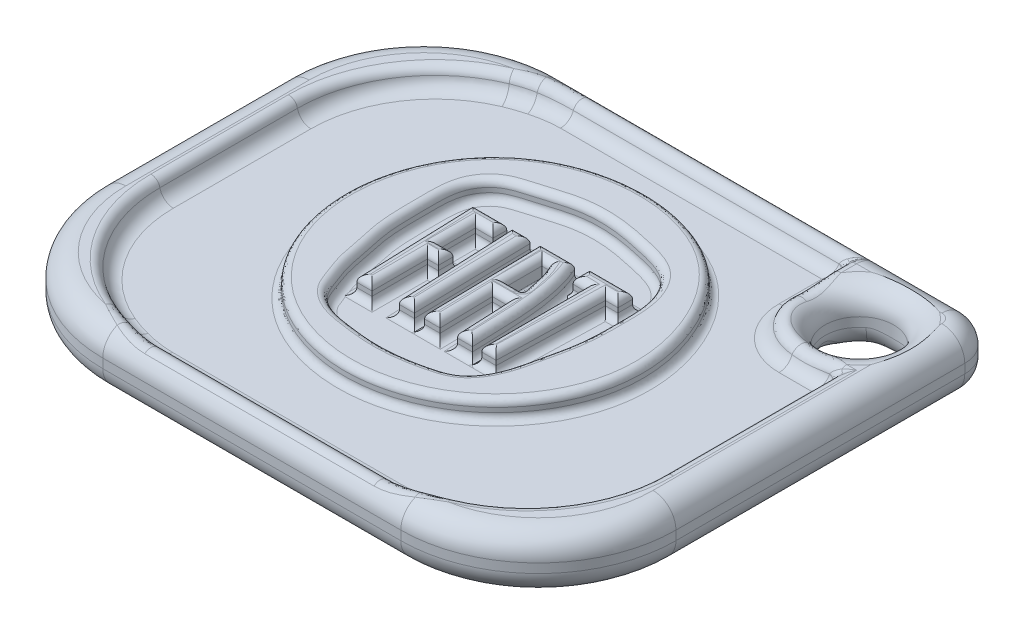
SolidWorks part; units mm, degrees
ref_plane "Ön Düzlem" through (0, 0, 0) normal (0, 0, 1) x (1, 0, 0)
ref_plane "Üst Düzlem" through (0, 0, 0) normal (0, 1, 0) x (1, 0, 0)
ref_plane "Sağ Düzlem" through (0, 0, 0) normal (1, 0, 0) x (0, 0, -1)
sketch "Çizim1" plane through (0, 0, 0) normal (0, 1, 0) x (1, 0, 0)
  line L1 (-41.6667, 37.8333) -> (53.3333, 37.8333)
  line L2 (-71.6667, 7.8333) -> (-71.6667, -32.1667)
  line L3 (-41.6667, -62.1667) -> (23.3333, -62.1667)
  line L4 (53.3333, 37.8333) -> (53.3333, -32.1667)
  arc A0 (23.3333, -62.1667) -> (53.3333, -32.1667) centre (23.3333, -32.1667) ccw
  arc A1 (-71.6667, -32.1667) -> (-41.6667, -62.1667) centre (-41.6667, -32.1667) ccw
  arc A2 (-41.6667, 37.8333) -> (-71.6667, 7.8333) centre (-41.6667, 7.8333) ccw
  circle A3 centre (38.3333, 22.8333) radius 7.5
  point P8 (-71.6667, -62.1667)
  point P11 (-71.6667, 37.8333)
  dimension "D3" = 30
  dimension "D4" = 15
  dimension "D1" = 100
  dimension "D2" = 125
  dimension "D5" = 15
extrude "Yükseklik-Ekstrüzyon1" add sketch "Çizim1" along normal blind 12
sketch "Çizim2" plane through (0, 12, 0) normal (0, 1, 0) x (1, 0, 0)
  line L0 (53.3333, 37.8333) -> (-41.6667, 37.8333) construction
  line L1 (-34.1667, 32.8333) -> (25.8333, 32.8333)
  line L2 (-64.1667, 2.8333) -> (-64.1667, -27.1667)
  line L3 (-34.1667, -57.1667) -> (15.8333, -57.1667)
  line L4 (45.8333, 10.8333) -> (45.8333, -27.1667)
  line L5 (-71.6667, 7.8333) -> (-71.6667, -32.1667) construction
  line L8 (25.8333, 32.8333) -> (25.8333, 20.8333)
  line L9 (35.8333, 10.8333) -> (45.8333, 10.8333)
  arc A0 (15.8333, -57.1667) -> (45.8333, -27.1667) centre (15.8333, -27.1667) ccw
  arc A1 (-64.1667, -27.1667) -> (-34.1667, -57.1667) centre (-34.1667, -27.1667) ccw
  arc A2 (-34.1667, 32.8333) -> (-64.1667, 2.8333) centre (-34.1667, 2.8333) ccw
  arc A3 (25.8333, 20.8333) -> (35.8333, 10.8333) centre (35.8333, 20.8333) ccw
  point P8 (-64.1667, -57.1667)
  point P11 (-64.1667, 32.8333)
  dimension "D3" = 30
  dimension "D8" = 10
  dimension "D1" = 90
  dimension "D2" = 110
  dimension "D4" = 5
  dimension "D5" = 7.5
extrude "Kes-Ekstrüzyon1" cut sketch "Çizim2" against normal blind 4
sketch "Çizim3" plane through (0, 0, 0) normal (0, -1, 0) x (1, 0, 0)
  line L0 (-41.6667, 62.1667) -> (23.3333, 62.1667) construction
  line L1 (-34.1667, 57.1667) -> (15.8333, 57.1667)
  line L2 (-64.1667, 27.1667) -> (-64.1667, -2.8333)
  line L3 (-34.1667, -32.8333) -> (25.8333, -32.8333)
  line L4 (45.8333, 27.1667) -> (45.8333, -10.8333)
  line L6 (-71.6667, -7.8333) -> (-71.6667, 32.1667) construction
  line L11 (25.8333, -32.8333) -> (25.8333, -20.8333)
  line L12 (35.8333, -10.8333) -> (45.8333, -10.8333)
  arc A0 (25.8333, -20.8333) -> (35.8333, -10.8333) centre (35.8333, -20.8333) cw
  arc A1 (-64.1667, -2.8333) -> (-34.1667, -32.8333) centre (-34.1667, -2.8333) ccw
  arc A2 (-34.1667, 57.1667) -> (-64.1667, 27.1667) centre (-34.1667, 27.1667) ccw
  arc A3 (15.8333, 57.1667) -> (45.8333, 27.1667) centre (15.8333, 27.1667) cw
  point P14 (25.8333, -10.8333)
  point P15 (-64.1667, -32.8333)
  point P18 (-64.1667, 57.1667)
  dimension "D7" = 10
  dimension "D1" = 30
  dimension "D2" = 90
  dimension "D3" = 5
  dimension "D4" = 7.5
  dimension "D5" = 22
  dimension "D6" = 20
extrude "Kes-Ekstrüzyon2" cut sketch "Çizim3" against normal blind 4
fillet "Radyus11" radius 5 15 edges at (5.8333, 12, -37.8333) (53.3333, 12, -2.8333) (44.5465, 12, 53.3799) (-9.1667, 12, 62.1667) (-62.8799, 12, 53.3799) (-71.6667, 12, 12.1667) (5.8333, 0, -37.8333) (53.3333, 0, -2.8333) (44.5465, 0, 53.3799) (-9.1667, 0, 62.1667) (-62.8799, 0, 53.3799) (-71.6667, 0, 12.1667) (38.3333, 12, -15.3333) (-62.8799, 12, -29.0465) (-62.8799, 0, -29.0465)
fillet "Radyus12" radius 5 1 edges at (38.3333, 0, -15.3333)
fillet "Radyus13" radius 3 10 edges at (-64.1667, 4, 12.1667) (-55.3799, 4, 48.3799) (-9.1667, 4, 57.1667) (37.0465, 4, 48.3799) (45.8333, 4, 8.1667) (40.8333, 4, -10.8333) (28.7623, 4, -13.7623) (25.8333, 4, -26.8333) (-4.1667, 4, -32.8333) (-55.3799, 4, -24.0465)
fillet "Radyus14" radius 3 2 edges at (25.8333, 0, -27.8333) (38.8331, 0.024, -10.8333)
fillet "Radyus15" radius 3 4 edges at (27.2654, 0.2614, -32.8333) (45.8333, 0.3856, -12.0869) (24.5654, 3.4495, -31.5654) (44.5447, 3.464, -9.5447)
fillet "Radyus18" radius 2 7 edges at (-55.3799, 12, -24.0465) (-64.1667, 12, 12.1667) (-9.1667, 12, 57.1667) (37.0465, 12, 48.3799) (-55.3799, 12, 48.3799) (-4.1667, 12, -32.8333) (45.8333, 12, 8.1667)
fillet "Radyus19" radius 7 3 edges at (51.8689, 1.4645, -36.3689) (51.8689, 10.5355, -36.3689) (53.3333, 6, -37.8333)
fillet "Radyus20" radius 3 10 edges at (40.8333, 8, -10.8333) (25.8333, 8, -26.8333) (-4.1667, 8, -32.8333) (45.8333, 8, 8.1667) (37.0465, 8, 48.3799) (-9.1667, 8, 57.1667) (-55.3799, 8, 48.3799) (-64.1667, 8, 12.1667) (28.7623, 8, -13.7623) (-55.3799, 8, -24.0465)
fillet "Radyus23" radius 2 6 edges at (44.8333, 12, -10.8333) (38.8333, 11.976, -10.8333) (25.8333, 12, -21.8333) (25.8333, 11.6709, -34.6174) (25.8333, 12, -27.8333)
fillet "Radyus24" radius 2 5 edges at (24.5399, 8.5327, -31.8614) (44.8317, 8.6762, -9.7307) (26.2034, 11.1204, -34.163) (46.5684, 11.5492, -11.4674)
sketch "Çizim10" plane through (0, 8, 0) normal (0, 1, 0) x (1, 0, 0)
  line L0 (125.6757, 467.3327) -> (808.3424, 467.3327) construction
  line L1 (-25.6672, 2.5281) -> (-24.7729, -23.6537)
  line L2 (-24.7729, -23.6537) -> (-21.4614, -23.6537)
  line L3 (-21.4614, -23.6537) -> (-21.4614, -11.5849)
  line L4 (-21.4614, -11.5849) -> (-19.0659, -11.5849)
  line L5 (-19.0659, -11.5849) -> (-19.0659, -8.3926)
  line L6 (-19.0659, -8.3926) -> (-22.0912, -8.3926)
  line L7 (-22.0912, -8.3926) -> (-22.0912, -0.5015)
  line L8 (-22.0912, -0.5015) -> (-18.2507, -0.5015)
  line L9 (-18.2507, -0.5015) -> (-18.2507, 2.5281)
  line L10 (-18.2507, 2.5281) -> (-25.6672, 2.5281)
  line L11 (-17.0931, 2.5281) -> (-15.9376, -23.2084)
  line L12 (-15.9376, -23.2084) -> (-12.6666, -23.2084)
  line L13 (-12.6666, -23.2084) -> (-13.1864, 2.5281)
  line L14 (-13.1864, 2.5281) -> (-17.0931, 2.5281)
  line L15 (-11.0203, 2.5281) -> (-10.9526, 2.5281)
  line L16 (-10.9526, 2.5281) -> (-10.4329, -23.2084)
  line L17 (-10.4329, -23.2084) -> (-7.0501, -23.2084)
  line L18 (-7.0501, -23.2084) -> (-7.2848, -11.5849)
  line L19 (-7.2848, -11.5849) -> (-3.7777, -11.5849)
  line L20 (-3.7777, -11.5849) -> (-3.2558, -23.2084)
  line L21 (-3.2558, -23.2084) -> (0, -23.2084)
  line L22 (-10.9526, 2.5281) -> (-3.456, 2.5281)
  line L23 (2.0408, -23.2084) -> (5.1622, -23.2084)
  line L24 (5.1622, -23.2084) -> (5.7865, 0)
  line L25 (5.7865, 0) -> (8.5177, 0)
  line L26 (8.5177, 0) -> (8.5177, 3.2065)
  line L27 (8.5177, 3.2065) -> (-0.8465, 3.2065)
  line L28 (-6.0359, -0.4238) -> (-7.6665, -0.4238)
  line L29 (2.0408, -0.5015) -> (2.0408, -23.2084)
  line L30 (2.0408, -0.5015) -> (-0.8465, -0.4238)
  line L31 (-0.8465, -0.4238) -> (-0.8465, 3.2065)
  line L32 (-7.6665, -0.4238) -> (-7.6665, -8.3926)
  line L33 (-7.6665, -8.3926) -> (-4.3419, -8.3926)
  spline S0 degree 3 poles (-8.2389, 25.7517) (-27.6894, 20.3353) (-38.5711, 7.5646) (-43.1326, -6.8972) (-40.5996, -23.4065) (-27.8686, -38.5698) (-7.0878, -44.2319) (14.112, -35.3333) (25.3291, -16.0879) (22.4938, 3.5692) (11.4738, 19.1292) (-8.2389, 25.7517) (-27.6894, 20.3353) (-38.5711, 7.5646) knots -0.288141 -0.210074 -0.114481 0 0.064684 0.125916 0.219571 0.297518 0.40697 0.512657 0.614952 0.711859 0.789926 0.885519 1 1.064684 1.125916 1.219571 only from (-29.3474, 16.9097) to (-29.3474, 16.9097)
  spline S1 degree 3 poles (-18.1927, 12.872) (-13.2522, 14.2689) (-6.779, 14.4419) (0.5599, 12.9113) (8.065, 11.0607) (12.0995, 4.0459) (12.1174, -3.5802) (12.1194, -11.5441) (10.207, -19.405) (8.9003, -26.3506) (5.0437, -31.3243) (0.8293, -32.5577) (-4.1668, -33.6774) (-9.9618, -34.1629) (-16.45, -33.3783) (-21.9313, -32.507) (-25.7452, -29.5767) (-27.1237, -25.8035) (-28.7888, -21.5863) (-29.5485, -16.5591) (-30.9131, -11.0357) (-31.0169, -5.5854) (-31.0867, 0.1083) (-30.8687, 5.5423) (-27.3803, 10.2358) (-22.5185, 11.5096) (-18.1927, 12.872) (-13.2522, 14.2689) (-6.779, 14.4419) knots -0.089788 -0.05403 -0.027742 0 0.046554 0.097156 0.149536 0.189373 0.245059 0.297813 0.345485 0.403715 0.435347 0.462544 0.487535 0.536677 0.575394 0.616277 0.644198 0.664458 0.694036 0.733459 0.7638 0.805708 0.839793 0.876502 0.910212 0.94597 0.972258 1 1.046554 1.097156 1.149536 only from (-14.1481, 13.8781) to (-14.1481, 13.8781)
  spline S2 degree 3 poles (-4.3419, -8.3926) (-3.6884, -8.5351) (-4.2551, -6.4864) (-4.5545, -5.2438) (-4.94, -3.0073) (-5.5598, -1.5033) (-6.0359, -0.4238) knots 0 0 0 0 0.225186 0.397559 0.579194 1 1 1 1
  spline S3 degree 3 poles (-3.456, 2.5281) (0.0634, -5.5027) (-0.4127, -14.7037) (0, -23.2084) knots 0 0 0 0 1 1 1 1
extrude "Yükseklik-Ekstrüzyon7" add sketch "Çizim10" along normal blind 4 contours S0 S1 | L9 L10 L1 L2 L3 L4 L5 L6 L7 L8 | L13 L14 L11 L12 | S3 L22 L16 L17 L18 L19 L20 L21 S2 L33 L32 L28 | L31 L30 L29 L23 L24 L25 L26 L27
fillet "Radyus41" radius 1.5 34 edges at (-16.5154, 8, 10.3401) (-14.3021, 8, 23.2084) (-12.9265, 8, 10.3401) (-15.1397, 8, -2.5281) (-25.22, 8, 10.5628) (-23.1171, 8, 23.6537) (-21.4614, 8, 17.6193) (-20.2637, 8, 11.5849) (-19.0659, 8, 9.9888) (-20.5785, 8, 8.3926) (-22.0912, 8, 4.4471) (-20.1709, 8, 0.5015) (-18.2507, 8, -1.0133) (-21.959, 8, -2.5281) (-7.2043, 8, -2.5281) (-10.6928, 8, 10.3401) (-8.7415, 8, 23.2084) (-7.1675, 8, 17.3967) (-5.5313, 8, 11.5849) (-3.5167, 8, 17.3967) (-1.6279, 8, 23.2084) (0.5972, 8, 0.4627) (2.0408, 8, 11.855) (3.6015, 8, 23.2084) (5.4744, 8, 11.6042) (7.1521, 8, 0) (8.5177, 8, -1.6032) (3.8356, 8, -3.2065) (-0.8465, 8, -1.3913)
fillet "Radyus42" radius 1.5 34 edges at (3.8356, 12, -3.2065) (8.5177, 12, -1.6032) (7.1521, 12, 0) (5.4744, 12, 11.6042) (3.6015, 12, 23.2084) (2.0408, 12, 11.855) (0.5972, 12, 0.4627) (-0.8465, 12, -1.3913) (-6.8512, 12, 0.4238) (-7.6665, 12, 4.4082) (-6.0042, 12, 8.3926) (-1.6279, 12, 23.2084) (-3.5167, 12, 17.3967) (-5.5313, 12, 11.5849) (-7.1675, 12, 17.3967) (-8.7415, 12, 23.2084) (-10.6928, 12, 10.3401) (-7.2043, 12, -2.5281) (-20.1709, 12, 0.5015) (-22.0912, 12, 4.4471) (-20.5785, 12, 8.3926) (-19.0659, 12, 9.9888) (-20.2637, 12, 11.5849) (-21.4614, 12, 17.6193) (-23.1171, 12, 23.6537) (-25.22, 12, 10.5628) (-21.959, 12, -2.5281) (-18.2507, 12, -1.0133) (-14.3021, 12, 23.2084) (-16.5154, 12, 10.3401) (-15.1397, 12, -2.5281) (-12.9265, 12, 10.3401)
fillet "Radyus43" radius 0.3 4 edges at (-6.0042, 8, 8.3926) (-7.6665, 8, 4.4082) (-6.8512, 8, 0.4238)
